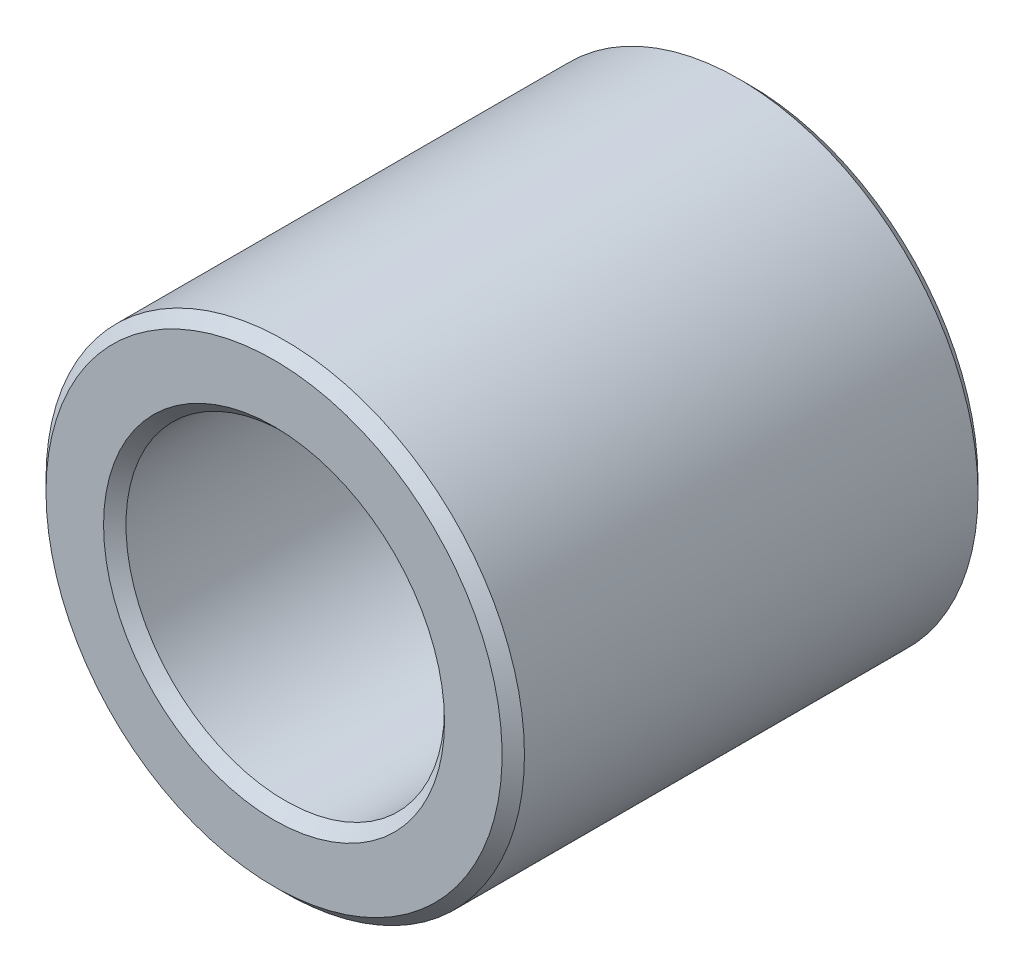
SolidWorks part; units mm, degrees
ref_plane "Front Plane" through (0, 0, 0) normal (0, 0, 1) x (1, 0, 0)
ref_plane "Top Plane" through (0, 0, 0) normal (0, 1, 0) x (1, 0, 0)
ref_plane "Right Plane" through (0, 0, 0) normal (1, 0, 0) x (0, 0, -1)
sketch "Sketch1" plane through (0, 0, 0) normal (0, 0, 1) x (1, 0, 0)
  line L0 (3.1877, 0) -> (4.7879, 0) construction
  circle A0 centre (0, 0) radius 3.1877 construction
  circle A1 centre (0, 0) radius 4.7879 construction
  circle A2 centre (0, 0) radius 4.7625 construction
  circle A3 centre (0, 0) radius 3.175 construction
sketch "Sketch13" plane through (0, 0, 0) normal (1, 0, 0) x (0, 0, -1)
  line L0 (4.7625, 0) -> (-4.7625, 0) construction
  line L1 (4.7625, 4.7879) -> (-4.7625, 4.7879) construction
  line L2 (0, 4.7879) -> (0, -4.7879) construction
  line L3 (0, 4.7879) -> (0, -4.7879) construction
  point P4 (0, 0)
  point P8 (0, 4.7879)
  dimension "Length" = 9.525
sketch "Sketch14" plane through (0, 0, 0) normal (0, 0, 1) x (1, 0, 0)
  circle A0 centre (0, 0) radius 3.1877 construction
  circle A1 centre (0, 0) radius 4.7879 construction
  circle A2 centre (0, 0) radius 3.1877
  circle A3 centre (0, 0) radius 4.7879
extrude "Boss-Extrude1" add sketch "Sketch14" against normal up to vertex (4.7625 mm away) and the other way up to vertex (4.7625 mm away)
chamfer "Chamfer1" distance 0.224 angle 45 4 edges at (4.7879, 0, -4.7625) (3.1877, 0, -4.7625) (3.1877, 0, 4.7625) (4.7879, 0, 4.7625)
equation "\"D1@Chamfer1\"=(\"OD@Sketch1\"-\"ID@Sketch1\")*.07"
